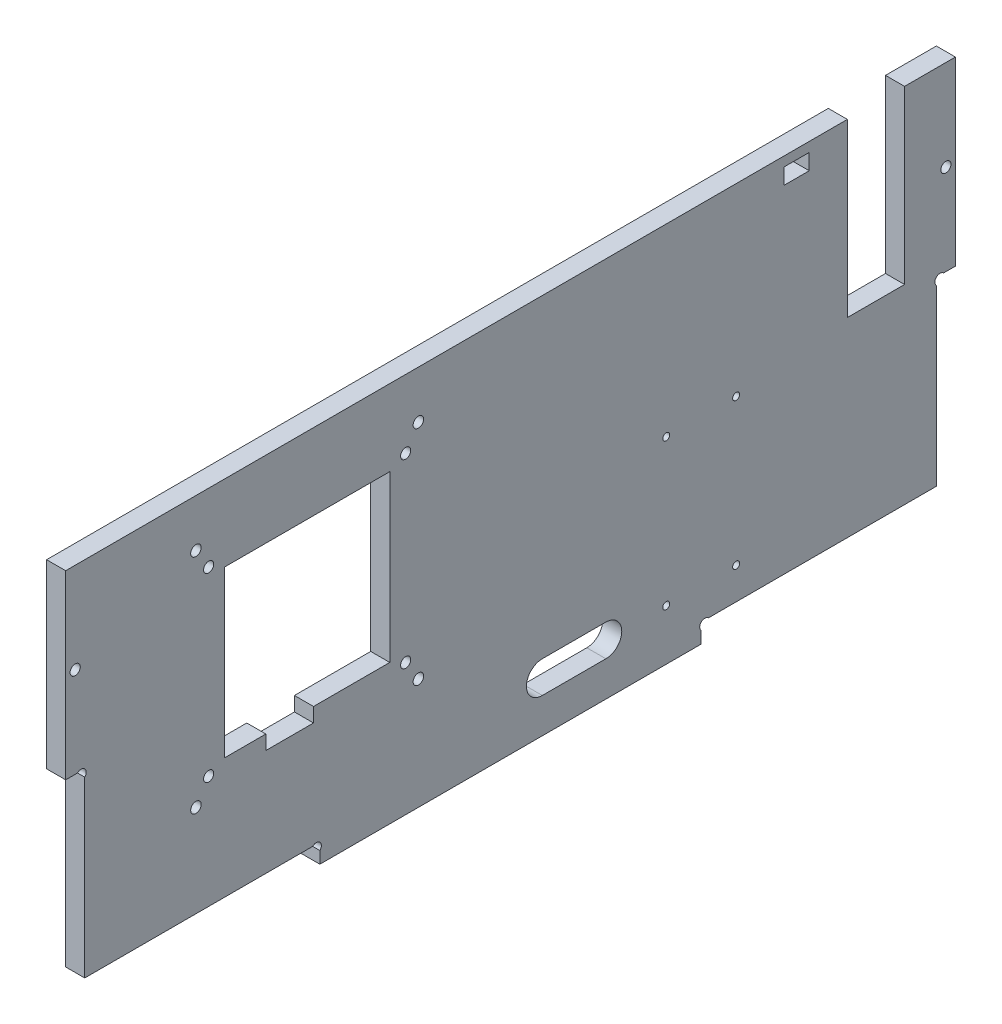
SolidWorks part; units mm, degrees
ref_plane "Plan de face" through (0, 0, 0) normal (0, 0, 1) x (1, 0, 0)
ref_plane "Plan de dessus" through (0, 0, 0) normal (0, 1, 0) x (1, 0, 0)
ref_plane "Plan de droite" through (0, 0, 0) normal (1, 0, 0) x (0, 0, -1)
sketch "Esquisse1" plane through (0, 0, 0) normal (1, 0, 0) x (0, 0, -1)
  line L0 (0, -8.7863) -> (0, 164.2561) construction
  line L1 (162.4375, 0) -> (-179.0121, 0) construction
  line L2 (140, 159.2561) -> (140, -13.7863) construction
  line L3 (-134, -13.7863) -> (-134, 159.2561) construction
  line L4 (61.0201, 6) -> (-179.0121, 6) construction
  line L5 (149.8466, 120) -> (-179.0121, 120) construction
  line L6 (60, -8.8557) -> (60, 98.4306) construction
  line L7 (134, -13.7863) -> (134, 59.403) construction
  line L8 (162.4375, 63) -> (-5.677, 63) construction
  line L9 (162.4375, 91.5) -> (123.6833, 91.5) construction
  line L10 (137, 102.0163) -> (137, 73.6224) construction
  line L11 (60, 6) -> (68.3298, -2.3298) construction
  line L12 (-60, 3.7373) -> (-60, 0)
  line L13 (-60, 0) -> (60, 0)
  line L14 (60, 0) -> (60, 3.7373)
  line L15 (62.2627, 6) -> (134, 6)
  line L16 (134, 6) -> (134, 60.7373)
  line L17 (136.2627, 63) -> (140, 63)
  line L18 (140, 63) -> (140, 120)
  line L19 (-62.2627, 6) -> (-134, 6)
  line L20 (-140, 63) -> (-140, 120)
  line L21 (134, 63) -> (147.7754, 49.2246) construction
  line L22 (124, 124.8253) -> (124, 25.419) construction
  line L23 (-140, 120) -> (106, 120)
  line L24 (106, 124.8253) -> (106, 25.419) construction
  line L25 (95.397, 66) -> (149.8466, 66) construction
  line L26 (106, 120) -> (106, 66)
  line L27 (106, 66) -> (124, 66)
  line L28 (124, 66) -> (124, 120)
  line L29 (124, 120) -> (140, 120)
  line L30 (-136.2627, 63) -> (-140, 63)
  line L31 (-134, 6) -> (-134, 60.7373)
  line L32 (-119, 159.2561) -> (-119, -13.7863) construction
  line L33 (-29, 159.2561) -> (-29, -13.7863) construction
  line L34 (-99, 149.3961) -> (-99, 5.0309) construction
  line L35 (-158.0111, 105) -> (-23.1525, 105) construction
  line L36 (-158.0111, 35) -> (-23.1525, 35) construction
  line L37 (-111.892, 70) -> (-16.609, 70) construction
  line L38 (-64, 137.6278) -> (-64, 65.4276) construction
  line L39 (-95, 128.3131) -> (-95, 98.5) construction
  line L40 (-24, 30) -> (-104, 30) construction
  line L41 (-24, 30) -> (-24, 110) construction
  line L42 (-24, 110) -> (-104, 110) construction
  line L43 (-104, 30) -> (-104, 110) construction
  line L44 (-24, 30) -> (-104, 110) construction
  line L45 (-24, 110) -> (-104, 30) construction
  line L46 (-38, 96) -> (-90, 96)
  line L47 (-38, 96) -> (-38, 44)
  line L48 (-38, 44) -> (-62, 44)
  line L49 (-90, 96) -> (-90, 44)
  line L50 (-38, 96) -> (-90, 44) construction
  line L51 (-38, 44) -> (-90, 96) construction
  line L52 (-127.5409, 41.5) -> (-27.1676, 41.5) construction
  line L53 (-127.5409, 98.5) -> (-87.8689, 98.5) construction
  line L54 (34.0855, 16) -> (-23.1525, 16) construction
  line L55 (71, 16) -> (49, 16) construction
  line L56 (71, 16) -> (71, 62) construction
  line L57 (71, 62) -> (49, 62) construction
  line L58 (49, 16) -> (49, 62) construction
  line L59 (71, 16) -> (49, 62) construction
  line L60 (71, 62) -> (49, 16) construction
  line L61 (10, 2.2811) -> (10, 32.9818) construction
  line L62 (30, 2.2811) -> (30, 32.9818) construction
  line L63 (30, 21) -> (10, 21)
  line L64 (10, 11) -> (30, 11)
  line L65 (90, 134.3298) -> (90, 102.0163) construction
  line L66 (54.1809, 114.5) -> (95.397, 114.5) construction
  line L67 (-112.995, 39.5) -> (-33, 39.5) construction
  line L68 (94, 117) -> (86, 117)
  line L69 (94, 117) -> (94, 112)
  line L70 (94, 112) -> (86, 112)
  line L71 (86, 117) -> (86, 112)
  line L72 (94, 117) -> (86, 112) construction
  line L73 (94, 112) -> (86, 117) construction
  line L74 (-97, 74.7969) -> (-97, 24.296) construction
  line L75 (-77, 32.9818) -> (-77, 48.2516) construction
  line L76 (-62, 24.296) -> (-62, 48.2516) construction
  line L77 (-77, 44) -> (-90, 44)
  line L79 (-62, 44) -> (-62, 39.5)
  line L80 (-62, 39.5) -> (-77, 39.5)
  line L81 (-77, 44) -> (-77, 39.5)
  arc A0 (62.2627, 6) -> (60, 3.7373) centre (61.1314, 4.8686) ccw
  arc A1 (-62.2627, 6) -> (-60, 3.7373) centre (-61.1314, 4.8686) cw
  circle A2 centre (137, 91.5) radius 1.6
  arc A3 (136.2627, 63) -> (134, 60.7373) centre (135.1314, 61.8686) ccw
  arc A4 (-136.2627, 63) -> (-134, 60.7373) centre (-135.1314, 61.8686) cw
  circle A5 centre (-137, 91.5) radius 1.6
  circle A6 centre (-99, 105) radius 1.65
  circle A7 centre (-29, 105) radius 1.65
  circle A8 centre (-29, 35) radius 1.65
  circle A9 centre (-99, 35) radius 1.65
  circle A10 centre (-95, 98.5) radius 1.6
  circle A11 centre (-33, 98.5) radius 1.6
  circle A12 centre (-33, 41.5) radius 1.6
  circle A13 centre (-95, 41.5) radius 1.6
  circle A14 centre (49, 62) radius 1.1
  circle A15 centre (49, 16) radius 1.1
  circle A16 centre (71, 16) radius 1.1
  circle A17 centre (71, 62) radius 1.1
  arc A18 (30, 11) -> (30, 21) centre (30, 16) ccw
  arc A19 (10, 21) -> (10, 11) centre (10, 16) ccw
  point P75 (-64, 70)
  point P88 (-64, 70)
  point P106 (60, 39)
  point P131 (90, 114.5)
  dimension "D10" = 3
  dimension "D11" = 45
  dimension "D12" = 18
  dimension "D4" = 15
  dimension "D21" = 57
  dimension "D24" = 10
  dimension "D25" = 10
  dimension "D1" = 6
  dimension "D2" = 114
  dimension "D3" = 140
  dimension "D5" = 60
  dimension "D6" = 63
  dimension "D7" = 28.5
  dimension "D8" = 6
  dimension "D9" = 45
  dimension "D13" = 54
  dimension "D14" = 16
  dimension "D15" = 90
  dimension "D16" = 70
  dimension "D17" = 70
  dimension "D18" = 15
  dimension "D19" = 35
  dimension "D20" = 35
  dimension "D22" = 31
  dimension "D23" = 28.5
  dimension "D26" = 20
  dimension "D27" = 5.5
  dimension "D28" = 230
  dimension "D29" = 30.5
  dimension "D30" = 33
  dimension "D31" = 15
  dimension "D32" = 35
extrude "Boss.-Extru.1" add sketch "Esquisse1" along normal blind 6
sketch "Esquisse2" plane through (0, 0, 0) normal (-1, 0, 0) x (0, 0, 1)
  line L0 (-110.2725, 120) -> (17, 120) construction
  line L1 (-106, 120) -> (140, 120) construction
  line L2 (-110.2725, 75) -> (17, 75) construction
  line L3 (-106, 136.0619) -> (-106, 84.6734) construction
  line L4 (-106, 66) -> (-106, 120) construction
  line L5 (-36, 136.0619) -> (-36, 55.7986) construction
  line L6 (-13, 89.5764) -> (-13, 58.3803) construction
  line L7 (-57.7953, 64) -> (-10.4427, 64) construction
  circle A0 centre (-36, 75) radius 1.1
  circle A1 centre (10, 75) radius 1.1
  circle A2 centre (10, 53) radius 1.1
  circle A3 centre (-36, 53) radius 1.1
  dimension "D1" = 23
  dimension "D2" = 11
  dimension "D3" = 45
  dimension "D4" = 70
extrude "Enlèv. mat.-Extru.1" cut sketch "Esquisse2" against normal blind 1
